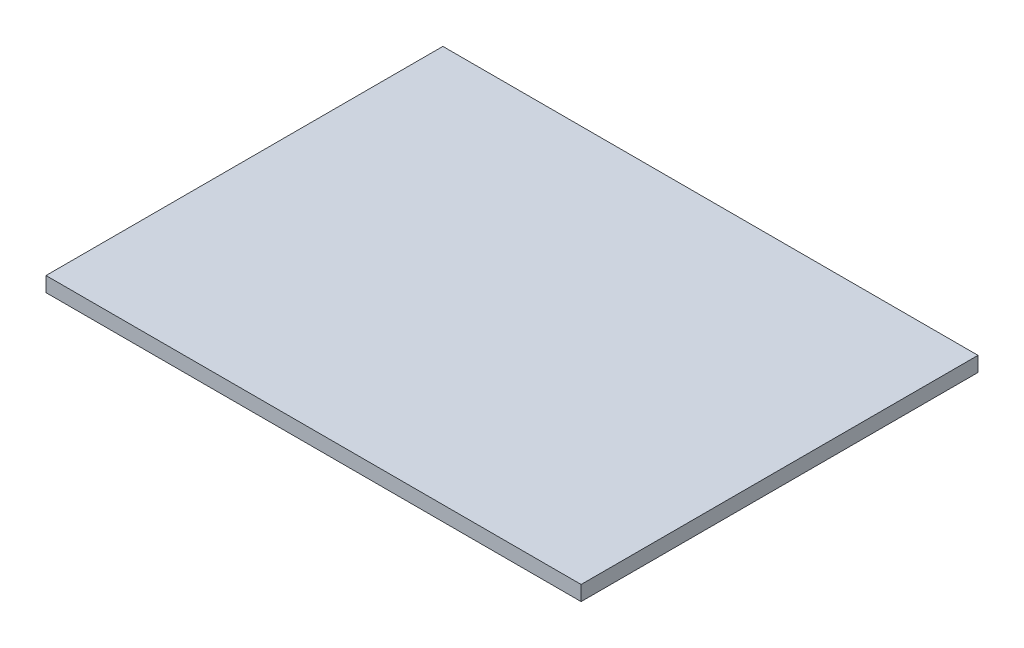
SolidWorks part; units mm, degrees
ref_plane "Front Plane" through (0, 0, 0) normal (0, 0, 1) x (1, 0, 0)
ref_plane "Top Plane" through (0, 0, 0) normal (0, 1, 0) x (1, 0, 0)
ref_plane "Right Plane" through (0, 0, 0) normal (1, 0, 0) x (0, 0, -1)
sketch "Sketch1" plane through (0, 0, 0) normal (0, 1, 0) x (1, 0, 0)
  line L1 (-180, 133.5) -> (180, 133.5)
  line L2 (-180, 133.5) -> (-180, -133.5)
  line L3 (-180, -133.5) -> (180, -133.5)
  line L4 (180, 133.5) -> (180, -133.5)
  line L5 (-180, 133.5) -> (180, -133.5) construction
  line L6 (-180, -133.5) -> (180, 133.5) construction
  point P0 (0, 0)
  dimension "D1" = 360
  dimension "D2" = 267
extrude "Boss-Extrude1" add sketch "Sketch1" along normal mid plane 10
sketch "Sketch2" plane through (0, 5, 0) normal (0, 1, 0) x (1, 0, 0)
  line L0 (180, -133.5) -> (180, 133.5) construction
  line L1 (-180, -133.5) -> (180, -133.5)
  line L2 (-180, -133.5) -> (-180, -113.5)
  line L3 (-180, -113.5) -> (180, -113.5)
  line L4 (180, -133.5) -> (180, -113.5)
  dimension "D1" = 20
extrude "Boss-Extrude2" [suppressed] add sketch "Sketch2" along normal blind 265
